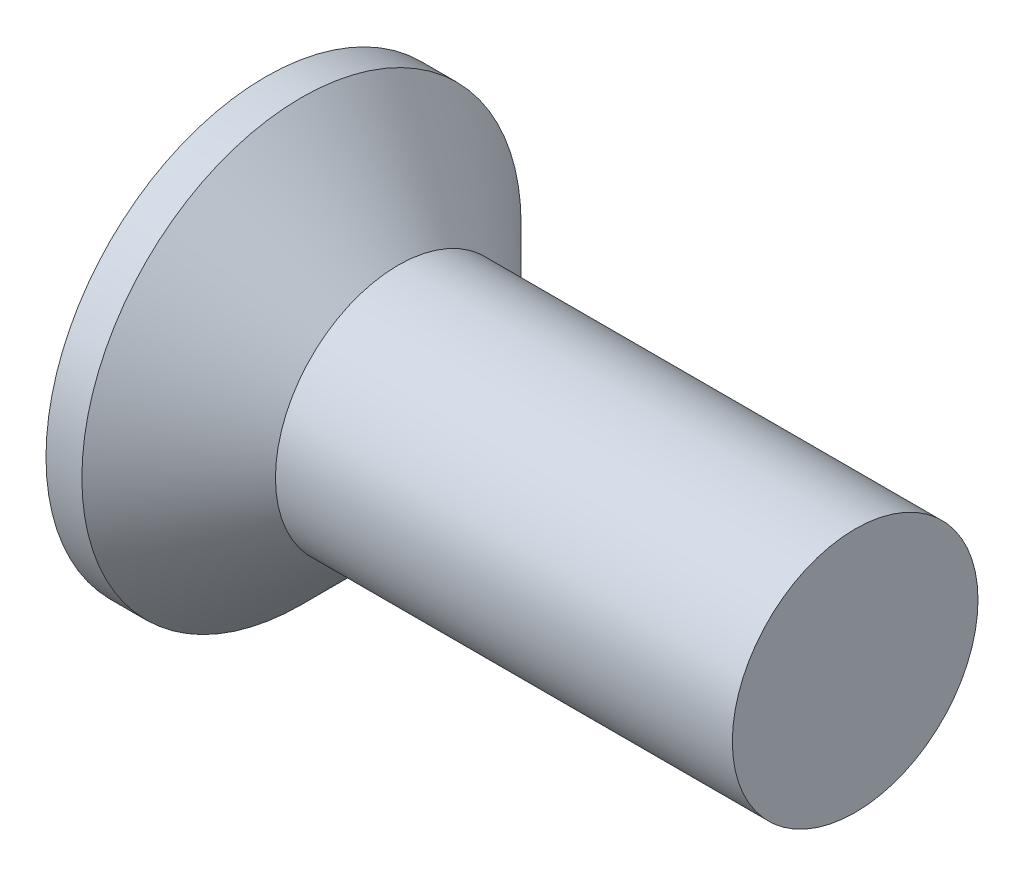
SolidWorks part; units mm, degrees
ref_plane "Front" through (0, 0, 0) normal (0, 0, 1) x (1, 0, 0)
ref_plane "Top" through (0, 0, 0) normal (0, 1, 0) x (1, 0, 0)
ref_plane "Right" through (0, 0, 0) normal (1, 0, 0) x (0, 0, -1)
sketch "Sketch1" plane through (0, 0, 0) normal (0, 0, 1) x (1, 0, 0)
  line L0 (12, 2.5) -> (4.3, 2.5)
  line L1 (4.3, 2.5) -> (2.7, 2.5)
  line L2 (2.7, 2.5) -> (0.73, 4.47)
  line L3 (0.73, 4.47) -> (0, 4.47)
  line L4 (12, 2.5) -> (12, 0)
  line L5 (4.5158, 0) -> (-89.8219, 0) construction
  line L6 (12, 0) -> (0, 0)
  line L7 (0, 4.47) -> (0, 0)
  dimension "D1" = 45
  dimension "d" = 5
  dimension "dk" = 8.94
  dimension "l" = 12
  dimension "k" = 2.7
  dimension "a" = 1.6
revolve "Base" add sketch "Sketch1" angle 360 about L5
sketch "Sketch6" plane through (0, 0, 0) normal (1, 0, 0) x (0, 0, -1)
  line L0 (-1.9271, 0) -> (2.0512, 0) construction
  line L1 (0, 1.8651) -> (0, -2.0207) construction
  line L2 (0.52, 0.52) -> (0.52, 2.6)
  line L3 (0.52, 2.6) -> (-0.52, 2.6)
  line L4 (-0.52, 0.52) -> (-0.52, 2.6)
  line L5 (0.52, 0.52) -> (2.6, 0.52)
  line L6 (2.6, 0.52) -> (2.6, -0.52)
  line L7 (-2.6, 0.52) -> (-2.6, -0.52)
  line L8 (-0.52, 0.52) -> (-2.6, 0.52)
  line L9 (-0.52, -0.52) -> (-2.6, -0.52)
  line L10 (0.52, -0.52) -> (2.6, -0.52)
  line L11 (-0.52, -0.52) -> (-0.52, -2.6)
  line L12 (0.52, -2.6) -> (-0.52, -2.6)
  line L13 (0.52, -0.52) -> (0.52, -2.6)
  point P16 (-2.6, 0)
  point P17 (2.6, 0)
  dimension "D1" = 1.04
  dimension "m" = 5.2
extrude "CrossRecess" cut sketch "Sketch6" along normal blind 1.35
draft "Draft9" type of draft neutral plane draft angle 30 faces to draft 4 parameters "D1"=30
fillet "Fillet5" radius 0.3 4 edges at (0.675, -0.52, -0.52) (0.675, 0.52, -0.52) (0.675, 0.52, 0.52) (0.675, -0.52, 0.52)
sketch "Sketch7" plane through (0, 0, 0) normal (1, 0, 0) x (0, 0, -1)
  line L0 (-2.0126, 0) -> (1.9757, 0) construction
  line L1 (0, 1.9314) -> (0, -2.0126) construction
  line L2 (0, 0) -> (1.5555, 1.5555) construction
  line L3 (0, 0.777) -> (1.8385, 1.8385)
  line L4 (-1.5402, 1.5402) -> (0, 0) construction
  line L5 (0.777, 0) -> (1.8385, 1.8385)
  line L6 (0, -0.777) -> (1.8385, -1.8385)
  line L7 (0.777, 0) -> (1.8385, -1.8385)
  line L8 (-0.777, 0) -> (-1.8385, -1.8385)
  line L9 (0, -0.777) -> (-1.8385, -1.8385)
  line L10 (-0.777, 0) -> (-1.8385, 1.8385)
  line L11 (0, 0.777) -> (-1.8385, 1.8385)
  dimension "D3" = 15
extrude "Cut-Extrude3" [suppressed] cut sketch "Sketch7" along normal blind 10 draft 20
sketch "Sketch8" plane through (0, 0, 0) normal (0, 0, 1) x (1, 0, 0)
  line L0 (-26, 2.933) -> (-28, 2.5)
  line L1 (-28, 2.5) -> (2.7, 2.5)
  line L3 (12, -2.5) -> (12, 2.5) construction
  line L6 (2.7, 2.5) -> (2.7, 7.5)
  line L7 (2.7, 7.5) -> (-26, 7.5)
  line L8 (-26, 7.5) -> (-26, 2.933)
  line L9 (62.4753, 0.433) -> (52.9594, 0.433) construction
  dimension "D1" = 5
  dimension "x" = 2
  dimension "b" = 38
sketch "Sketch9" plane through (0, 0, 0) normal (0, 0, 1) x (1, 0, 0)
  line L0 (12, 2.125) -> (12.2165, 2.5)
  line L1 (12.2165, 2.5) -> (12.2165, 2.933)
  line L2 (12.2165, 2.933) -> (11.7835, 2.933)
  line L3 (11.7835, 2.933) -> (11.7835, 2.5)
  line L4 (11.7835, 2.5) -> (12, 2.125)
  line L5 (0, 0) -> (73.843, 0) construction
  line L6 (12, -2.5) -> (12, 2.5) construction
  dimension "D1" = 5
  dimension "D2" = 0.433
revolve "Cut-Revolve10" [suppressed] cut sketch "Sketch9" angle 360 about L5
pattern_linear "LPattern10" [suppressed] count 18 spacing 0.5196 along (1, 0, 0)
equation "\"D1@Sketch6\" = \"m@Sketch6\" / 5"
equation "\"D1@CrossRecess\" = \"k@Sketch1\" / 2"
equation "\"D1@Sketch9\" = \"d@Sketch1\""
equation "\"D2@Sketch9\" =  ( \"d@Sketch1\" - \"THD_MINOR@ThreadCosmetic1\" )  / 2"
equation "\"D3@LPattern10\" = \"D2@Sketch9\" * 1.2"
equation "\"D1@LPattern10\" = \"bb@ThreadCosmetic1\" / \"D3@LPattern10\" "
